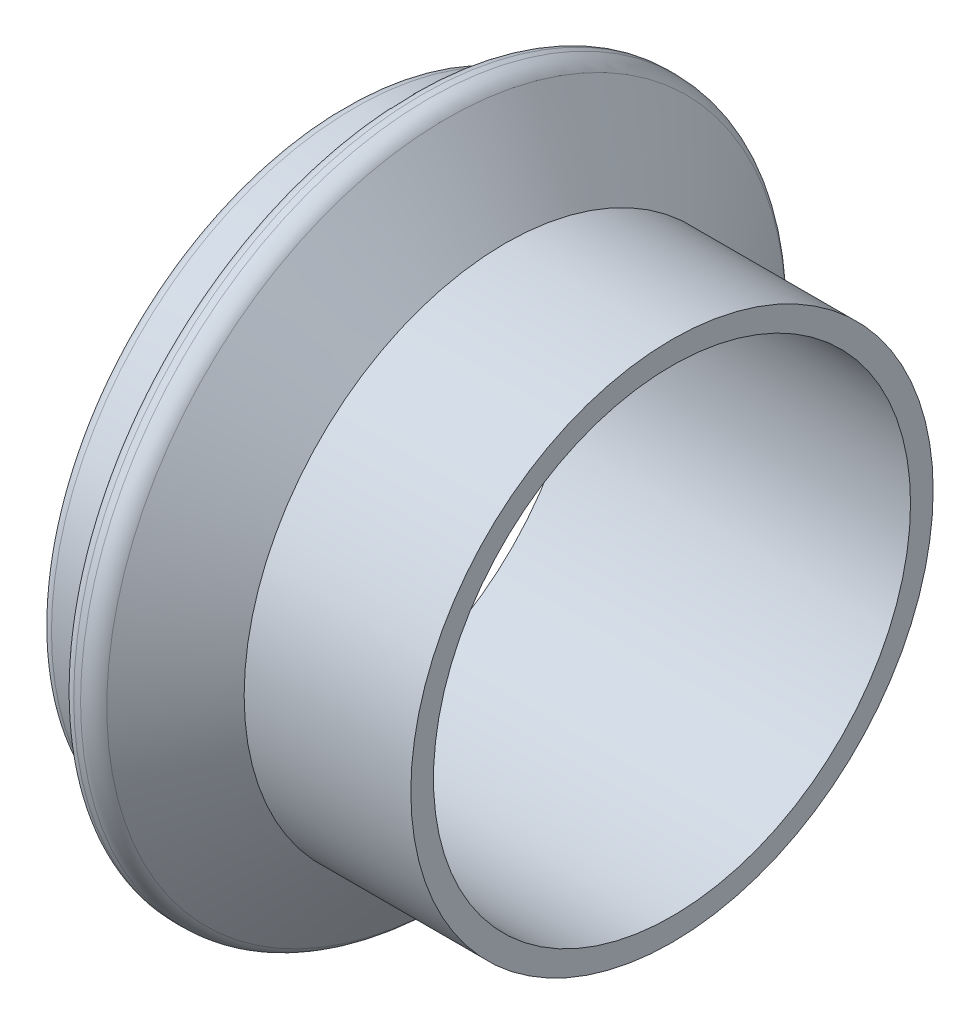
SolidWorks part; units mm, degrees
ref_plane "Front Plane" through (0, 0, 0) normal (0, 0, 1) x (1, 0, 0)
ref_plane "Top Plane" through (0, 0, 0) normal (0, 1, 0) x (1, 0, 0)
ref_plane "Right Plane" through (0, 0, 0) normal (1, 0, 0) x (0, 0, -1)
sketch "Sketch1" plane through (0, 0, 0) normal (0, 0, 1) x (1, 0, 0)
  line L0 (0.7514, 17.399) -> (-23.2516, 17.399)
  line L1 (-23.2516, 17.399) -> (-23.2516, 21.2598)
  line L2 (-22.4388, 22.0726) -> (-19.1114, 22.0726)
  line L3 (-18.2986, 22.8854) -> (-18.2986, 24.5872)
  line L4 (-17.4858, 25.4) -> (-16.9882, 25.4)
  line L5 (-15.7102, 24.7628) -> (-11.4053, 19.05)
  line L7 (-11.4053, 19.05) -> (0.7514, 19.05)
  line L8 (0.7514, 19.05) -> (0.7514, 17.399)
  line L9 (0, 0) -> (-27.9762, 0) construction
  arc A0 (-17.4858, 25.4) -> (-18.2986, 24.5872) centre (-17.4858, 24.5872) ccw
  arc A1 (-18.2986, 22.8854) -> (-19.1114, 22.0726) centre (-19.1114, 22.8854) cw
  arc A2 (-22.4388, 22.0726) -> (-23.2516, 21.2598) centre (-22.4388, 21.2598) ccw
  arc A5 (-15.7102, 24.7628) -> (-16.9882, 25.4) centre (-16.9882, 23.7998) ccw
  point P11 (-18.2986, 25.4)
  point P17 (-23.2516, 22.0726)
  point P22 (-12.736, 20.8159)
  point P25 (-16.1904, 25.4)
  dimension "D4" = 0.8128
  dimension "D1" = 4.953
  dimension "D2" = 5.5626
  dimension "D3" = 24.003
  dimension "D5" = 17.399
  dimension "D6" = 19.05
  dimension "D7" = 25.4
  dimension "D8" = 22.0726
revolve "Revolve1" add sketch "Sketch1" angle 360 about L9
